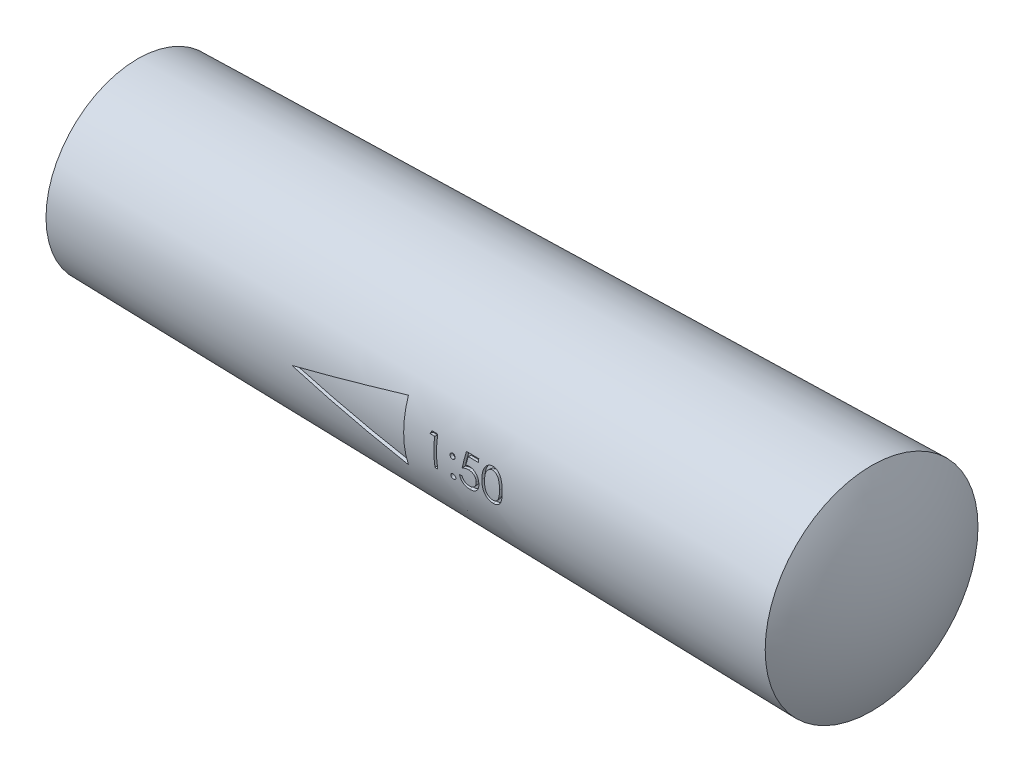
SolidWorks part; units mm, degrees
ref_plane "Front Plane" through (0, 0, 0) normal (0, 0, 1) x (1, 0, 0)
ref_plane "Top Plane" through (0, 0, 0) normal (0, 1, 0) x (1, 0, 0)
ref_plane "Right Plane" through (0, 0, 0) normal (1, 0, 0) x (0, 0, -1)
sketch "Sketch1" plane through (0, 0, 0) normal (1, 0, 0) x (0, 0, -1)
  circle A0 centre (0, 0) radius 3
  dimension "D1" = 6
extrude "Extrude1" add sketch "Sketch1" along normal mid plane 24
draft "Draft1" type of draft neutral plane draft angle 1.146 faces to draft 1 parameters "D1"=1.146
sketch "Sketch2" plane through (0, 0, 0) normal (0, 0, 1) x (1, 0, 0)
  line L0 (-12, 0) -> (-12, 3)
  line L1 (-12, 3) -> (-12, -3) construction
  line L2 (-12, 0) -> (-12.9, 0)
  line L3 (-12.9, 0) -> (-12.9, -3.24) construction
  line L4 (12, 0) -> (12, 3.48)
  line L5 (12, -3.48) -> (12, 3.48) construction
  line L6 (12, 0) -> (12.9, 0)
  line L7 (12.9, 0) -> (12.9, -3.24) construction
  line L8 (-12, -3) -> (12, -3.48) construction
  arc A0 (-12.9, 0) -> (-12, 3) centre (-7.45, 0) cw
  arc A1 (12.9, 0) -> (12, 3.48) centre (5.7219, 0) ccw
  point P14 (0, -3.24)
revolve "Revolve1" add sketch "Sketch2" angle 360 about L2
sketch "Sketch5" plane through (0, 0, 0) normal (0, 0, 1) x (1, 0, 0)
  line L0 (0, 3.24) -> (0, -3.24) construction
  line L1 (12, 3.48) -> (-12, 3) construction
  line L2 (-12, -3) -> (12, -3.48) construction
ref_plane "Plane2" through (0, 0, 0) normal (-0.02, 0, 0.9998) x (0.9998, 0, 0.02)
sketch "Sketch6" plane through (0, 0, 0) normal (-0.02, 0, 0.9998) x (0.9998, 0, 0.02)
  line L0 (0, 0) -> (0, 1)
  line L1 (0, 3.24) -> (0, -3.24) construction
  line L2 (0, 1) -> (-3.7321, 0)
  line L3 (-3.7321, 0) -> (0, -1)
  line L4 (0, -1) -> (0, 0)
  line L5 (0, -0.5) -> (4, -0.5) construction
  text T0 "1:50" font "Century Gothic" height 1
  dimension "D1" = 2
  dimension "D2" = 30
  dimension "D3" = 4
wrap "Wrap2" sketch "Sketch6" wrap type deboss source sketch "Sketch6" thickness 0.1 parameters "D1"=0.1
equation "\"D2@Sketch2\" = \"D1@Sketch2\""
